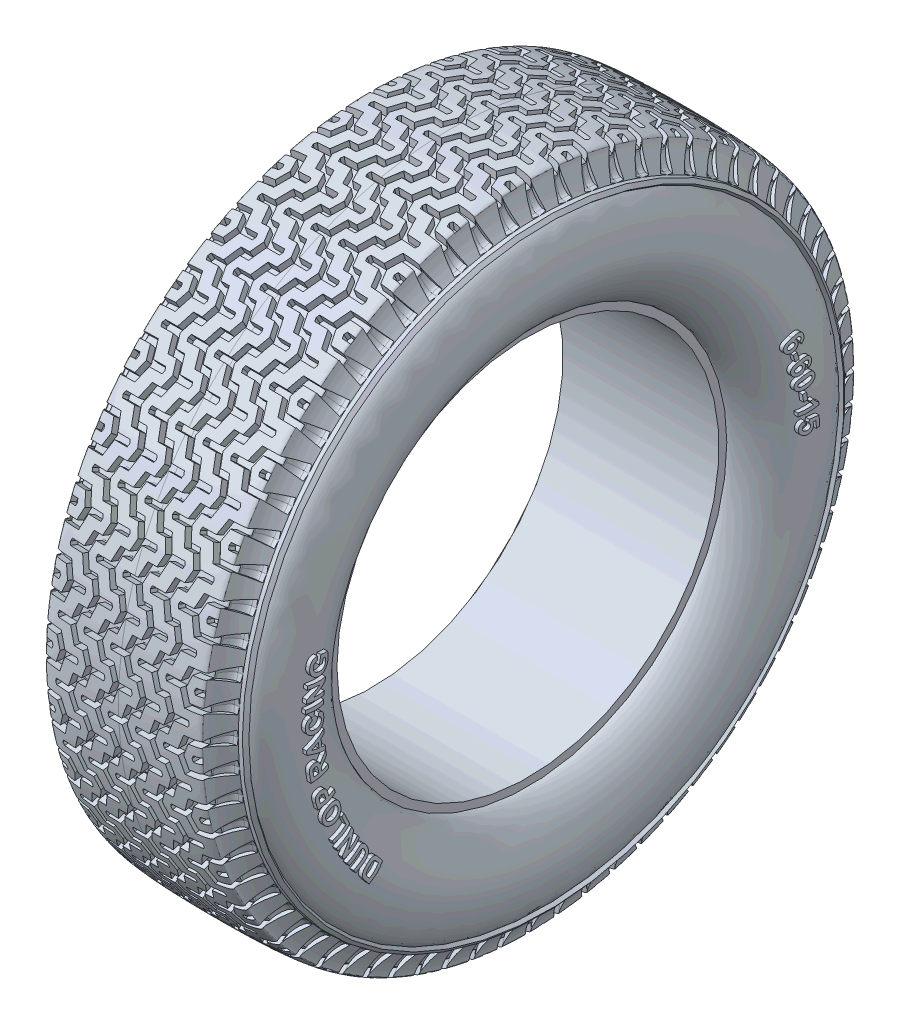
SolidWorks part; units mm, degrees
ref_plane "Plan de face" through (0, 0, 0) normal (0, 0, 1) x (1, 0, 0)
ref_plane "Plan de dessus" through (0, 0, 0) normal (0, 1, 0) x (1, 0, 0)
ref_plane "Plan de droite" through (0, 0, 0) normal (1, 0, 0) x (0, 0, -1)
sketch "Esquisse1" plane through (0, 0, 0) normal (0, 0, 1) x (1, 0, 0)
  line L0 (0, 0) -> (0, 8.4192) construction
  line L1 (-2, 4.9) -> (2, 4.9)
  line L2 (2, 4.9) -> (2, 5.1)
  line L3 (0.8189, 8.5) -> (-0.8189, 8.5) construction
  line L4 (-2.4768, 7.6351) -> (-2.4, 7.5711)
  line L5 (2.3, 7.7273) -> (2.4, 7.7273)
  line L6 (2.4, 7.7273) -> (2.4768, 7.6351)
  line L7 (2.4768, 7.6351) -> (2.4, 7.5711)
  line L8 (-2.4, 7.7273) -> (-2.4768, 7.6351)
  line L9 (2.8, 5.7589) -> (2.8, 6.5121) construction
  line L10 (-2.3, 7.7273) -> (-2.4, 7.7273)
  line L11 (-2, 4.9) -> (-2, 5.1)
  line L12 (0, 0) -> (2.9097, 0) construction
  spline S0 degree 3 poles (2.4, 7.5711) (2.6509, 7.3581) (2.81, 6.6707) (2.7891, 5.8458) (2.1865, 5.1317) (2, 5.1) knots 0 0 0 0 0.325372 0.425372 1 1 1 1
  spline S1 degree 3 poles (0, 8.5) (1.0237, 8.5) (1.9834, 8.4686) (2, 8.3422) knots 0 0 0 0 1 1 1 1
  spline S2 degree 3 poles (2, 8.3422) (2.0213, 8.1804) (2.1592, 7.9343) (2.3, 7.7273) knots 0 0 0 0 1 1 1 1
  spline S3 degree 3 poles (-2, 8.3422) (-2.0213, 8.1804) (-2.1592, 7.9343) (-2.3, 7.7273) knots 0 0 0 0 1 1 1 1
  spline S4 degree 3 poles (0, 8.5) (-1.0237, 8.5) (-1.9834, 8.4686) (-2, 8.3422) knots 0 0 0 0 1 1 1 1
  spline S5 degree 3 poles (-2.4, 7.5711) (-2.6509, 7.3581) (-2.81, 6.6707) (-2.7891, 5.8458) (-2.1865, 5.1317) (-2, 5.1) knots 0 0 0 0 0.325372 0.425372 1 1 1 1
  point P25 (0, 4.9)
  dimension "D12" = 0.1578
  dimension "D1" = 4.9
  dimension "D2" = 2
  dimension "D3" = 0.2
  dimension "D4" = 8.5
  dimension "D5" = 0.1
  dimension "D6" = 0.1
  dimension "D7" = 0.12
  dimension "D8" = 2.8
  dimension "D9" = 2
  dimension "D10" = 2.3
  dimension "D11" = 1.5
  dimension "D13" = 0.7727
revolve "Révolution1" add sketch "Esquisse1" angle 360 about L12
sketch "Esquisse12" plane through (0, 0, 0) normal (1, 0, 0) x (0, 0, -1)
  circle A0 centre (0, 0) radius 6.1 construction
  text T0 "DUNLOP RACING                                                                                6-60-15" font "Arial" height 0.5
  dimension "D1" = 12.2
extrude "Boss.-Extru.1" add sketch "Esquisse12" along normal offset from surface (2.8692 mm away) 0.1
ref_plane "Plan2" through (0, 0, -0.04) normal (0, 0, 1) x (1, 0, 0)
sketch "Esquisse4" plane through (0, 0, -0.04) normal (0, 0, 1) x (1, 0, 0)
  line L0 (0, 8.5) -> (2.4979, 8.5) construction
ref_plane "Plan3" through (0, 0.2631, -1.4924) normal (0, -0.1736, 0.9848) x (1, 0, 0)
ref_plane "Plan5" through (0, 8.5, 0) normal (0, 1, 0) x (-1, 0, 0)
sketch "Esquisse7" plane through (0, 8.5, 0) normal (0, 1, 0) x (-1, 0, 0)
  line L0 (0, 0) -> (-2.2183, 0) construction
  line L1 (-2, 0.811) -> (2, 0.811) construction
  line L2 (-2, -0.075) -> (2, -0.075) construction
  line L3 (-1.545, 0.075) -> (2, 0.075) construction
  line L4 (-2, 0.661) -> (2, 0.661) construction
  line L5 (-2, 1.547) -> (2, 1.547) construction
  line L6 (-2, 1.397) -> (2, 1.397) construction
  line L7 (-0.42, -0.4406) -> (-0.42, 1.7794) construction
  line L8 (-2, -0.075) -> (-2, 1.4926) construction
  line L9 (-2, -0.075) -> (-2, 0.075)
  line L10 (-2, 0.075) -> (-1.7197, 0.075)
  line L11 (-1.7197, 0.075) -> (-1.6123, 0.368)
  line L12 (-1.6123, 0.368) -> (-1.7197, 0.661)
  line L13 (-1.7197, 0.661) -> (-2, 0.661)
  line L14 (-2, 0.661) -> (-2, 0.811)
  line L15 (-2, 0.811) -> (-1.615, 0.811)
  line L16 (0, 0) -> (0, 1.8076) construction
  line L17 (0, 8.5) -> (0, -8.5) construction
  line L18 (-1.615, 0.811) -> (-1.48, 0.443)
  line L19 (0.28, 1.7794) -> (0.28, -0.406) construction
  line L20 (0.98, 1.7794) -> (0.98, -0.4319) construction
  line L21 (-1.12, -0.3508) -> (-1.12, 1.7673) construction
  line L22 (-1.48, 0.293) -> (-1.615, -0.075)
  line L23 (-1.615, -0.075) -> (-2, -0.075)
  line L24 (1.68, 1.7794) -> (1.68, -0.4579) construction
  line L25 (-0.915, 0.811) -> (-0.78, 0.443)
  line L26 (-0.9123, 0.368) -> (-1.0197, 0.661)
  line L27 (2, 8.3422) -> (2, -8.3422) construction
  line L28 (-0.78, 0.443) -> (-0.4475, 0.443)
  line L29 (-0.4475, 0.443) -> (-0.42, 0.368)
  line L30 (-0.42, 0.368) -> (-0.4475, 0.293)
  line L31 (-0.78, 0.293) -> (-0.4475, 0.293)
  line L32 (-0.78, 0.293) -> (-0.915, -0.075)
  line L33 (-1.0197, 0.075) -> (-0.9123, 0.368)
  line L34 (-1.14, 0.811) -> (-0.915, 0.811)
  line L35 (-0.915, -0.075) -> (-1.3, -0.075)
  line L36 (-1.3, -0.075) -> (-1.245, 0.075)
  line L37 (-1.245, 0.075) -> (-1.0197, 0.075)
  line L38 (-2, 0.368) -> (2, 0.368) construction
  line L39 (-1.2447, 0.661) -> (-1.3797, 1.029)
  line L40 (-1.2447, 0.661) -> (-1.0197, 0.661)
  line L41 (-1.3797, 1.029) -> (-1.7122, 1.029)
  line L42 (-1.7122, 1.029) -> (-1.7397, 1.104)
  line L43 (-1.7397, 1.104) -> (-1.7122, 1.179)
  line L44 (-2, 0.443) -> (2, 0.443) construction
  line L45 (2, 0.293) -> (-2, 0.293) construction
  line L46 (-1.7122, 1.179) -> (-1.3797, 1.179)
  line L47 (-2, 0.443) -> (-1.8275, 0.443)
  line L48 (-1.1475, 0.443) -> (-1.12, 0.368)
  line L49 (-1.8275, 0.293) -> (-2, 0.293)
  line L50 (-2, 0.293) -> (-2, 0.443)
  line L51 (-1.3797, 1.179) -> (-1.2447, 1.547)
  line L52 (-1.2447, 1.547) -> (-0.8597, 1.547)
  line L53 (-0.8597, 1.547) -> (-0.9148, 1.397)
  line L54 (-0.9148, 1.397) -> (-1.14, 1.397)
  line L55 (-2, 8.3422) -> (-2, -8.3422) construction
  line L56 (-2, 1.104) -> (2, 1.104) construction
  line L57 (-1.8275, 0.443) -> (-1.8, 0.368)
  line L58 (-1.8, 0.368) -> (-1.8275, 0.293)
  line L59 (-1.14, 1.397) -> (-1.2475, 1.104)
  line L60 (-1.2475, 1.104) -> (-1.14, 0.811)
  line L61 (-0.1597, 1.547) -> (-0.2148, 1.397)
  line L62 (-0.5447, 1.547) -> (-0.1597, 1.547)
  line L63 (-0.6797, 1.179) -> (-0.5447, 1.547)
  line L64 (-0.2148, 1.397) -> (-0.44, 1.397)
  line L65 (-0.44, 1.397) -> (-0.5475, 1.104)
  line L66 (-0.5475, 1.104) -> (-0.44, 0.811)
  line L67 (-1.12, 0.368) -> (-1.1475, 0.293)
  line L68 (-0.44, 0.811) -> (-0.215, 0.811)
  line L69 (-0.08, 0.443) -> (0, 0.443)
  line L70 (0, 1.179) -> (0, 1.029)
  line L71 (0, 0.443) -> (0, 0.293)
  line L72 (-0.08, 0.293) -> (0, 0.293)
  line L73 (-0.08, 0.293) -> (-0.215, -0.075)
  line L74 (-0.215, -0.075) -> (-0.6, -0.075)
  line L75 (-0.6, -0.075) -> (-0.545, 0.075)
  line L76 (-0.545, 0.075) -> (-0.3197, 0.075)
  line L77 (-0.3197, 0.075) -> (-0.2123, 0.368)
  line L78 (-0.2123, 0.368) -> (-0.3197, 0.661)
  line L79 (-0.5447, 0.661) -> (-0.3197, 0.661)
  line L80 (-0.5447, 0.661) -> (-0.6797, 1.029)
  line L81 (-0.6797, 1.029) -> (-1.0122, 1.029)
  line L82 (-1.0122, 1.029) -> (-1.0397, 1.104)
  line L83 (-1.0397, 1.104) -> (-1.0122, 1.179)
  line L84 (-1.0122, 1.179) -> (-0.6797, 1.179)
  line L87 (-1.48, 0.293) -> (-1.1475, 0.293)
  line L89 (-1.48, 0.443) -> (-1.1475, 0.443)
  line L91 (-2, 1.179) -> (2, 1.179) construction
  line L92 (-2, 1.029) -> (2, 1.029) construction
  line L108 (0, 1.029) -> (-0.3122, 1.029)
  line L109 (-0.3122, 1.029) -> (-0.3397, 1.104)
  line L110 (-0.3397, 1.104) -> (-0.3122, 1.179)
  line L111 (-0.3122, 1.179) -> (0, 1.179)
  line L112 (-0.215, 0.811) -> (-0.08, 0.443)
  line L190 (-0.44, 0.368) -> (-0.4675, 0.293)
  line L191 (-0.4675, 0.443) -> (-0.44, 0.368)
  line L192 (0.2525, 0.443) -> (0.28, 0.368)
  line L193 (0.28, 0.368) -> (0.2525, 0.293)
  line L194 (0.5403, 1.547) -> (0.4852, 1.397)
  line L195 (0.1553, 1.547) -> (0.5403, 1.547)
  line L196 (0.1002, 1.397) -> (0.1553, 1.547)
  line L197 (0.4852, 1.397) -> (0.26, 1.397)
  line L198 (0.26, 1.397) -> (0.1525, 1.104)
  line L199 (0.1525, 1.104) -> (0.26, 0.811)
  line L200 (0.26, 0.811) -> (0.485, 0.811)
  line L201 (0.62, 0.443) -> (0.9525, 0.443)
  line L202 (0.9525, 0.443) -> (0.98, 0.368)
  line L203 (0.98, 0.368) -> (0.9525, 0.293)
  line L204 (0.62, 0.293) -> (0.9525, 0.293)
  line L205 (0.62, 0.293) -> (0.485, -0.075)
  line L206 (0.485, -0.075) -> (0.1, -0.075)
  line L207 (0.1, -0.075) -> (0.155, 0.075)
  line L208 (0.155, 0.075) -> (0.3803, 0.075)
  line L209 (0.3803, 0.075) -> (0.4877, 0.368)
  line L210 (0.4877, 0.368) -> (0.3803, 0.661)
  line L211 (0.1553, 0.661) -> (0.3803, 0.661)
  line L212 (0.1553, 0.661) -> (0.1002, 0.811)
  dimension "D1" = 0.15
  dimension "D3" = 0.15
  dimension "D4" = 0.15
  dimension "D5" = 0.15
  dimension "D6" = 0.075
  dimension "D7" = 0.88
  dimension "D8" = 0.15
  dimension "D9" = 0.15
  dimension "D10" = 3
  dimension "D11" = 0.36
  dimension "D12" = 0.2
  dimension "D13" = 2
  dimension "D14" = 0.886
  dimension "D15" = 0.443
  dimension "D16" = 0.385
  dimension "D17" = 1.58
  dimension "D18" = 2.28
  dimension "D19" = 0.075
  dimension "D20" = 0.886
  dimension "D21" = 2.98
  dimension "D22" = 0.443
  dimension "D23" = 0.075
  dimension "D24" = 0.15
  dimension "D25" = 3.68
  dimension "D26" = 2
  dimension "D27" = 0.385
  dimension "D28" = 0.385
  dimension "D29" = 0.36
  dimension "D30" = 0.15
  dimension "D31" = 0.15
  dimension "D32" = 0.225
  dimension "D33" = 0.3397
  dimension "D35" = 0.08
  dimension "D36" = 0.315
  dimension "D34" = 3
extrude "Enlèv. mat.-Extru.4" cut sketch "Esquisse7" against normal offset from surface (0.3973 mm away) 0.2
sketch "Esquisse8" plane through (0, 0, 0) normal (0, 0, 1) x (1, 0, 0)
  line L0 (2, 8.4307) -> (2.3, 7.7273)
  line L1 (2.3, 7.7273) -> (2.1941, 7.7452)
  line L2 (2, 8.4307) -> (2, 8.0901)
  line L3 (2, 8.3419) -> (2, -8.3422) construction
  spline S0 degree 3 poles (2, 8.0901) (2.0074, 7.9762) (2.12, 7.7544) (2.1941, 7.7452) knots 0 0 0 0 1 1 1 1
ref_plane "Plan6" through (0, 0.2631, -1.4924) normal (0, -0.1736, 0.9848) x (1, 0, 0)
sketch "Esquisse9" plane through (0, 0.2631, -1.4924) normal (0, -0.1736, 0.9848) x (1, 0, 0)
  line L0 (2, 8.4745) -> (2.3068, 7.593)
  line L1 (2.3068, 7.593) -> (2.2011, 7.6192)
  line L2 (2, 8.4745) -> (2, 7.9672)
  spline S0 degree 3 poles (2, 7.9672) (2.0195, 7.8259) (2.1296, 7.6311) (2.2011, 7.6192) knots 0 0 0 0 1 1 1 1
ref_plane "Plan7" through (4.7137, 2.0103, 0.3403) normal (0.9178, 0.3914, 0.0663) x (0.1784, -0.2575, -0.9497)
sketch "Esquisse10" plane through (4.7137, 2.0103, 0.3403) normal (0.9178, 0.3914, 0.0663) x (0.1784, -0.2575, -0.9497)
  line L0 (-1.5798, 6.0108) -> (-1.4169, 6.0736)
sketch "Esquisse11" plane through (0, 8.5, 0) normal (0, 1, 0) x (-1, 0, 0)
  line L0 (0, -0.1968) -> (0, 1.6541) construction
  line L2 (2, -0.1968) -> (2, 1.8268) construction
  line L3 (2, 8.3422) -> (2, -8.3422) construction
  line L4 (-2, 1.716) -> (-2, -0.2718) construction
  line L5 (-2, -8.3422) -> (-2, 8.3422) construction
  line L6 (-0.215, -0.075) -> (2, -0.075) construction
  line L7 (-0.3197, 0.075) -> (2, 0.075) construction
  line L8 (-0.4475, 0.293) -> (2, 0.293) construction
  line L9 (-0.42, 0.368) -> (2, 0.368) construction
  line L10 (-0.4475, 0.443) -> (2, 0.443) construction
  line L11 (-0.3197, 0.661) -> (2, 0.661) construction
  line L12 (-0.215, 0.811) -> (2, 0.811) construction
  line L13 (0, 1.029) -> (2, 1.029) construction
  line L14 (0, 1.179) -> (2, 1.179) construction
  line L15 (-0.3397, 1.104) -> (2, 1.104) construction
  line L16 (-0.2148, 1.397) -> (2, 1.397) construction
  line L17 (-0.1597, 1.547) -> (2, 1.547) construction
  line L18 (0, 1.029) -> (-0.3122, 1.029) construction
  line L19 (0, 1.029) -> (-0.3122, 1.029) construction
  line L20 (0, 0.443) -> (0, 0.293)
  line L21 (0, 0.293) -> (0.2525, 0.293)
  line L22 (0.2525, 0.293) -> (0.28, 0.368)
  line L23 (0.28, 0.368) -> (0.2525, 0.443)
  line L24 (0.2525, 0.443) -> (0, 0.443)
  line L25 (-0.08, 0.293) -> (-0.215, -0.075) construction
  line L26 (-0.215, 0.811) -> (-0.08, 0.443) construction
  line L27 (0.0203, 1.179) -> (0, 1.179)
  line L28 (0, 1.179) -> (0, 1.029)
  line L29 (0, 1.029) -> (0.0203, 1.029)
  line L30 (0.0203, 1.029) -> (0.1553, 0.661)
  line L31 (0.1553, 0.661) -> (0.3803, 0.661)
  line L32 (0.3803, 0.661) -> (0.4877, 0.368)
  line L33 (0.4877, 0.368) -> (0.3803, 0.075)
  line L34 (0.3803, 0.075) -> (0.155, 0.075)
  line L35 (0.155, 0.075) -> (0.1, -0.075)
  line L36 (0.1, -0.075) -> (0.485, -0.075)
  line L37 (0.485, -0.075) -> (0.62, 0.293)
  line L38 (0.62, 0.293) -> (0.9525, 0.293)
  line L39 (0.9525, 0.293) -> (0.98, 0.368)
  line L40 (0.98, 0.368) -> (0.9525, 0.443)
  line L41 (0.9525, 0.443) -> (0.62, 0.443)
  line L42 (0.62, 0.443) -> (0.485, 0.811)
  line L43 (0.485, 0.811) -> (0.26, 0.811)
  line L44 (0.26, 0.811) -> (0.1525, 1.104)
  line L45 (0.1525, 1.104) -> (0.26, 1.397)
  line L46 (0.26, 1.397) -> (0.4852, 1.397)
  line L47 (0.4852, 1.397) -> (0.5403, 1.547)
  line L48 (0.5403, 1.547) -> (0.1553, 1.547)
  line L49 (0.1553, 1.547) -> (0.0203, 1.179)
  line L50 (-0.1597, 1.547) -> (-0.2148, 1.397) construction
  line L51 (1.1852, 1.397) -> (1.2403, 1.547)
  line L52 (1.2403, 1.547) -> (0.8553, 1.547)
  line L53 (0.8553, 1.547) -> (0.7203, 1.179)
  line L54 (0.7203, 1.029) -> (0.8553, 0.661)
  line L55 (0.8553, 0.661) -> (1.0803, 0.661)
  line L56 (1.0803, 0.661) -> (1.1877, 0.368)
  line L57 (1.1877, 0.368) -> (1.0803, 0.075)
  line L58 (1.0803, 0.075) -> (0.855, 0.075)
  line L59 (0.855, 0.075) -> (0.8, -0.075)
  line L60 (0.8, -0.075) -> (1.185, -0.075)
  line L61 (1.185, -0.075) -> (1.32, 0.293)
  line L62 (1.32, 0.293) -> (1.6525, 0.293)
  line L63 (1.6525, 0.293) -> (1.68, 0.368)
  line L64 (1.68, 0.368) -> (1.6525, 0.443)
  line L65 (1.6525, 0.443) -> (1.32, 0.443)
  line L66 (1.32, 0.443) -> (1.185, 0.811)
  line L67 (1.185, 0.811) -> (0.96, 0.811)
  line L68 (0.96, 0.811) -> (0.8525, 1.104)
  line L69 (0.8525, 1.104) -> (0.96, 1.397)
  line L70 (0.96, 1.397) -> (1.1852, 1.397)
  line L71 (1.5553, 1.547) -> (2, 1.547)
  line L72 (2, 1.547) -> (2, 1.397)
  line L73 (1.5553, 1.547) -> (1.4203, 1.179)
  line L74 (1.4203, 1.029) -> (1.5553, 0.661)
  line L75 (2, 1.397) -> (1.66, 1.397)
  line L76 (1.66, 0.811) -> (2, 0.811)
  line L77 (2, 0.811) -> (2, 0.661)
  line L78 (2, 0.661) -> (1.5553, 0.661)
  line L79 (0.7203, 1.179) -> (0.3878, 1.179)
  line L80 (0.3878, 1.179) -> (0.3603, 1.104)
  line L81 (0.3603, 1.104) -> (0.3878, 1.029)
  line L82 (0.3878, 1.029) -> (0.7203, 1.029)
  line L83 (1.4203, 1.179) -> (1.0878, 1.179)
  line L84 (1.0878, 1.029) -> (1.4203, 1.029)
  line L85 (1.0878, 1.179) -> (1.0603, 1.104)
  line L86 (1.0603, 1.104) -> (1.0878, 1.029)
  line L87 (2, 1.179) -> (1.7878, 1.179)
  line L88 (1.66, 0.811) -> (1.5525, 1.104)
  line L89 (1.5525, 1.104) -> (1.66, 1.397)
  line L90 (1.7878, 1.029) -> (2, 1.029)
  line L91 (1.7878, 1.179) -> (1.7603, 1.104)
  line L92 (1.7603, 1.104) -> (1.7878, 1.029)
  line L93 (2, 1.179) -> (2, 1.029)
  line L162 (2.02, 0.443) -> (1.885, 0.811)
  line L163 (1.8852, 1.397) -> (1.9403, 1.547)
  line L164 (1.66, 1.397) -> (1.8852, 1.397)
  line L165 (1.9403, 1.547) -> (1.5553, 1.547)
  line L166 (1.7803, 0.661) -> (1.8877, 0.368)
  line L167 (1.8877, 0.368) -> (1.7803, 0.075)
  line L168 (1.885, -0.075) -> (2.02, 0.293)
  line L169 (2.02, 0.293) -> (2.3525, 0.293)
  line L170 (2.3525, 0.443) -> (2.02, 0.443)
  line L171 (1.7803, 0.075) -> (1.555, 0.075)
  line L172 (1.555, 0.075) -> (1.5, -0.075)
  line L173 (1.5, -0.075) -> (1.885, -0.075)
  line L174 (2.3525, 0.293) -> (2.38, 0.368)
  line L175 (2.38, 0.368) -> (2.3525, 0.443)
  line L176 (1.5553, 0.661) -> (1.7803, 0.661)
  line L177 (1.885, 0.811) -> (1.66, 0.811)
  dimension "D1" = 0.36
  dimension "D2" = 0.36
  dimension "D3" = 0.36
  dimension "D4" = 0.385
  dimension "D5" = 0.315
  dimension "D6" = 0.385
  dimension "D7" = 0.15
  dimension "D8" = 0.15
  dimension "D10" = 3
  dimension "D11" = 0.36
  dimension "D9" = 0.15
extrude "Enlèv. mat.-Extru.5" cut sketch "Esquisse11" against normal offset from surface (0.2088 mm away) 0.2
pattern_circular "Répétition circulaire4" count 36 over 360 of "Enlèv. mat.-Extru.4", "Enlèv. mat.-Extru.5"
loft "Enlèvement de matière-Lissage1" cut profiles "Esquisse8", "Esquisse9"
mirror "Symétrie1" about plane through (0, 0, 0) normal (0, 0, 1) of "Enlèvement de matière-Lissage1"
pattern_circular "Répétition circulaire5" count 72 over 360 of "Symétrie1", "Enlèvement de matière-Lissage1"
mirror "Symétrie2" about plane through (0, 0, 0) normal (1, 0, 0) of "Répétition circulaire5", "Enlèvement de matière-Lissage1", "Symétrie1"
